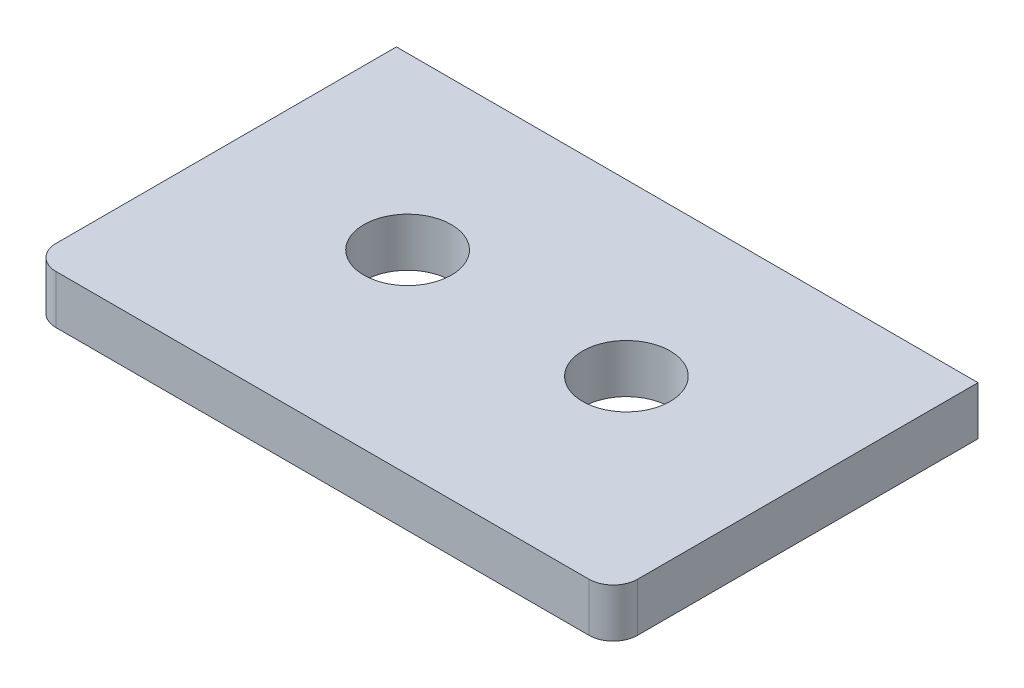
SolidWorks part; units mm, degrees
ref_plane "Plan de face" through (0, 0, 0) normal (0, 0, 1) x (1, 0, 0)
ref_plane "Plan de dessus" through (0, 0, 0) normal (0, 1, 0) x (1, 0, 0)
ref_plane "Plan de droite" through (0, 0, 0) normal (1, 0, 0) x (0, 0, -1)
ref_plane "Plan1" through (0, 2.5, 0) normal (0, 1, 0) x (1, 0, 0)
sketch "Esquisse1" plane through (0, 2.5, 0) normal (0, 1, 0) x (1, 0, 0)
  line L0 (29.9, 0) -> (-29.9, 0)
  line L1 (-29.9, 0) -> (-29.9, -35)
  line L2 (-27.4, -37.5) -> (27.4, -37.5)
  line L3 (29.9, -35) -> (29.9, 0)
  circle A0 centre (11.25, -17.5) radius 4.5
  circle A1 centre (-11.25, -17.5) radius 4.5
  arc A2 (-29.9, -35) -> (-27.4, -37.5) centre (-27.4, -35) ccw
  arc A3 (27.4, -37.5) -> (29.9, -35) centre (27.4, -35) ccw
extrude "Boss.-Extru.1" add sketch "Esquisse1" against normal blind 5
